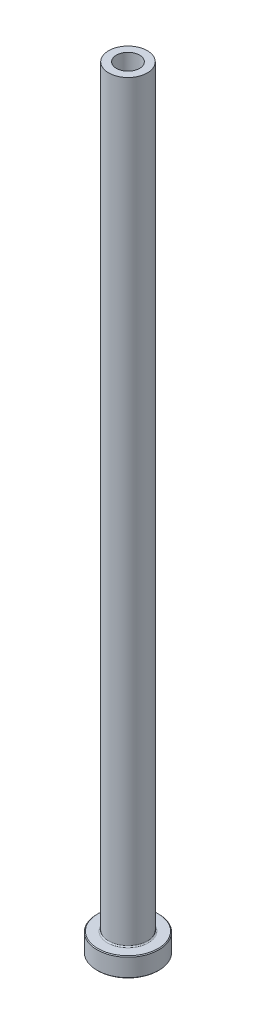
SolidWorks part; units mm, degrees
ref_plane "Front Plane" through (0, 0, 0) normal (0, 0, 1) x (1, 0, 0)
ref_plane "Top Plane" through (0, 0, 0) normal (0, 1, 0) x (1, 0, 0)
ref_plane "Right Plane" through (0, 0, 0) normal (1, 0, 0) x (0, 0, -1)
sketch "Sketch1" plane through (0, 0, 0) normal (0, 0, 1) x (1, 0, 0)
  line L0 (-3, 200) -> (-5, 200)
  line L1 (-5, 200) -> (-5, 5)
  line L2 (-5, 5) -> (-8, 5)
  line L3 (-8, 5) -> (-8, 0)
  line L4 (8.8, 0) -> (-8.8, 0) construction
  line L5 (-8, 0) -> (-3.25, 0)
  line L6 (-3, 155) -> (-3, 200)
  line L7 (0, 92.1877) -> (0, -15.5353) construction
  line L8 (0, -8.8) -> (0, 8.8) construction
  line L9 (-3, 155) -> (-3.25, 143)
  line L10 (-3.25, 143) -> (-3.25, 0)
  dimension "D1" = 0.25
  dimension "ID" = 6
  dimension "OD" = 10
  dimension "L" = 200
  dimension "H" = 16
  dimension "T" = 5
  dimension "N" = 45
  dimension "D2" = 12
revolve "Revolve1" add sketch "Sketch1" angle 360 about L7
fillet "Fillet1" radius 0.3 1 edges at (0, 5, 5)
chamfer "Chamfer1" distance 0.2 angle 45 2 edges at (0, 5, 8) (0, 0, 8)
chamfer "Chamfer3" distance 0.5 angle 45 1 edges at (0, 0, 3.25)
